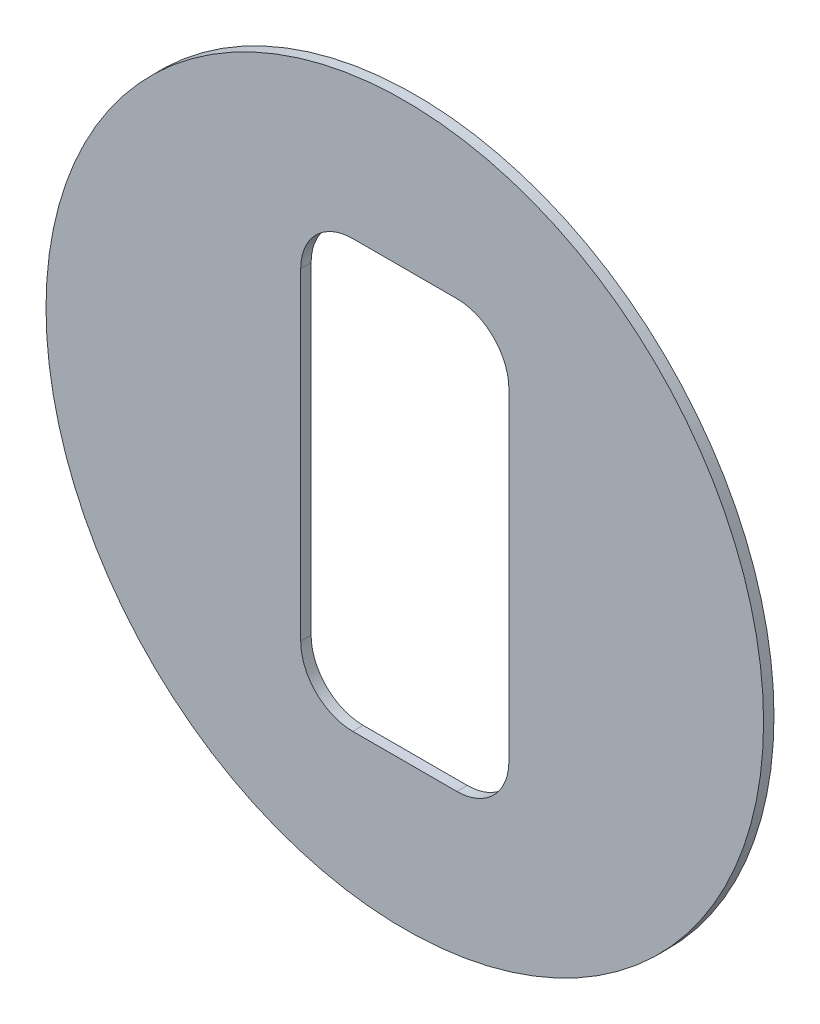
SolidWorks part; units mm, degrees
ref_plane "Front Plane" through (0, 0, 0) normal (0, 0, 1) x (1, 0, 0)
ref_plane "Top Plane" through (0, 0, 0) normal (0, 1, 0) x (1, 0, 0)
ref_plane "Right Plane" through (0, 0, 0) normal (1, 0, 0) x (0, 0, -1)
sketch "Sketch1" plane through (0, 0, 0) normal (0, 0, 1) x (1, 0, 0)
  line L0 (0, 0) -> (2417.0447, 0) construction
  line L1 (0, 0) -> (0, 1034.0298) construction
  circle A0 centre (0, 0) radius 1723.5
  dimension "D1" = 3447
extrude "Boss-Extrude1" add sketch "Sketch1" against normal blind 50
sketch "Sketch2" plane through (0, 0, 0) normal (0, 0, 1) x (1, 0, 0)
  line L0 (0, 0) -> (917.7015, 0) construction
  line L1 (0, 0) -> (0, 542.8657) construction
  line L3 (250, -1025) -> (-250, -1025)
  line L4 (500, -775) -> (500, 775)
  line L5 (250, 1025) -> (-250, 1025)
  line L6 (-500, -775) -> (-500, 775)
  line L7 (500, -1025) -> (-500, 1025) construction
  line L8 (500, 1025) -> (-500, -1025) construction
  arc A0 (250, -1025) -> (500, -775) centre (250, -775) ccw
  arc A1 (-250, -1025) -> (-500, -775) centre (-250, -775) cw
  arc A2 (500, 775) -> (250, 1025) centre (250, 775) ccw
  arc A3 (-250, 1025) -> (-500, 775) centre (-250, 775) ccw
  point P1 (0, 0)
  dimension "D3" = 250
  dimension "D1" = 1000
  dimension "D2" = 2050
extrude "Cut-Extrude1" cut sketch "Sketch2" against normal through all
